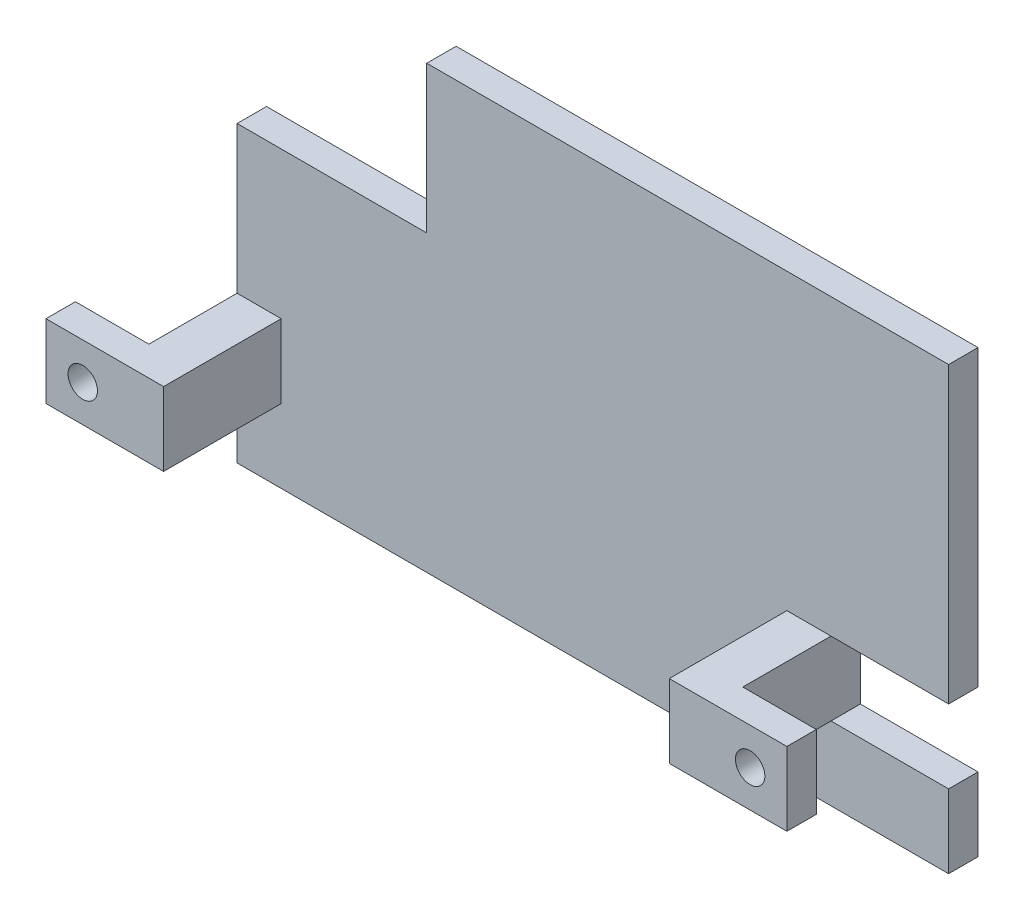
SolidWorks part; units mm, degrees
ref_plane "Alzado" through (0, 0, 0) normal (0, 0, 1) x (1, 0, 0)
ref_plane "Planta" through (0, 0, 0) normal (0, 1, 0) x (1, 0, 0)
ref_plane "Vista lateral" through (0, 0, 0) normal (1, 0, 0) x (0, 0, -1)
sketch "Croquis1" plane through (0, 0, 0) normal (0, 0, 1) x (1, 0, 0)
  line L1 (-0.3876, 13.329) -> (48.0124, 13.329)
  line L2 (-0.3876, 13.329) -> (-0.3876, -16.671)
  line L3 (-0.3876, -16.671) -> (48.0124, -16.671)
  line L4 (48.0124, 13.329) -> (48.0124, -16.671)
  dimension "D1" = 30
  dimension "D2" = 48.4
extrude "Saliente-Extruir1" add sketch "Croquis1" along normal blind 2
sketch "Croquis2" plane through (0, 0, 2) normal (0, 0, 1) x (1, 0, 0)
  line L0 (-0.3876, -6.671) -> (48.0124, -6.671) construction
  line L1 (-0.3876, 13.329) -> (-0.3876, -16.671) construction
  line L2 (48.0124, -16.671) -> (48.0124, 13.329) construction
  line L3 (48.0124, 13.329) -> (-0.3876, 13.329) construction
  line L4 (-0.3876, -11.671) -> (48.0124, -11.671) construction
  line L5 (40.0124, -11.671) -> (40.0124, -6.671)
  line L6 (-0.3876, -16.671) -> (48.0124, -16.671) construction
  line L7 (40.0124, -11.671) -> (40.0124, -6.671) construction
  line L8 (40.0124, -6.671) -> (48.0124, -6.671)
  line L9 (48.0124, -6.671) -> (48.0124, -11.671)
  line L10 (48.0124, -11.671) -> (40.0124, -11.671)
  dimension "D1" = 20
  dimension "D2" = 5
  dimension "D3" = 5
  dimension "D4" = 8
extrude "Cortar-Extruir1" cut sketch "Croquis2" against normal blind 2
sketch "Croquis3" plane through (0, 0, 2) normal (0, 0, 1) x (1, 0, 0)
  line L0 (40.0124, -6.671) -> (40.0124, -11.671)
  line L1 (40.0124, -6.671) -> (37.0124, -6.671)
  line L2 (40.0124, -11.671) -> (37.0124, -11.671)
  line L3 (37.0124, -6.671) -> (37.0124, -11.671)
  line L4 (37.0124, -11.671) -> (-0.3876, -11.671) construction
  line L5 (-0.3876, 13.329) -> (-0.3876, -16.671) construction
  line L7 (-0.3876, -11.671) -> (2.6124, -11.671)
  line L8 (-0.3876, -11.671) -> (-0.3876, -6.671)
  line L9 (-0.3876, -6.671) -> (2.6124, -6.671)
  line L10 (2.6124, -11.671) -> (2.6124, -6.671)
  dimension "D1" = 3
  dimension "D2" = 5
  dimension "D3" = 3
extrude "Saliente-Extruir2" add sketch "Croquis3" along normal blind 8
sketch "Croquis4" plane through (0, 0, 10) normal (0, 0, 1) x (1, 0, 0)
  line L0 (-0.3876, -11.671) -> (-0.3876, -6.671)
  line L1 (-0.3876, -11.671) -> (-5.3876, -11.671)
  line L2 (-0.3876, -6.671) -> (-5.3876, -6.671)
  line L3 (-5.3876, -11.671) -> (-5.3876, -6.671)
  line L4 (40.0124, -6.671) -> (40.0124, -11.671)
  line L5 (40.0124, -6.671) -> (45.0124, -6.671)
  line L6 (40.0124, -11.671) -> (45.0124, -11.671)
  line L7 (45.0124, -6.671) -> (45.0124, -11.671)
  line L8 (-5.3876, -11.671) -> (-0.3876, -6.671) construction
  line L9 (-5.3876, -6.671) -> (-0.3876, -11.671) construction
  line L10 (40.0124, -11.671) -> (45.0124, -6.671) construction
  line L11 (45.0124, -11.671) -> (40.0124, -6.671) construction
  circle A0 centre (-2.8876, -9.171) radius 1
  circle A1 centre (42.5124, -9.171) radius 1
  point P0 (-2.8876, -9.171)
  point P15 (42.5124, -9.171)
  dimension "D3" = 2
  dimension "D4" = 2
  dimension "D1" = 5
  dimension "D2" = 5
extrude "Saliente-Extruir3" add sketch "Croquis4" against normal blind 2
sketch "Croquis5" plane through (0, 0, 0) normal (0, 0, -1) x (-1, 0, 0)
  line L0 (-48.0124, -16.671) -> (-48.0124, -11.671)
  line L1 (-48.0124, -16.671) -> (-40.0124, -16.671)
  line L2 (-48.0124, -11.671) -> (-40.0124, -11.671)
  line L3 (-40.0124, -16.671) -> (-40.0124, -11.671)
  line L4 (-12.5124, -16.671) -> (-12.5124, 13.329) construction
  line L5 (0.3876, -16.671) -> (-48.0124, -16.671) construction
  line L6 (-48.0124, 13.329) -> (0.3876, 13.329) construction
  line L7 (-12.5124, -16.671) -> (-12.5124, -11.671)
  line L8 (-12.5124, -16.671) -> (-20.5124, -16.671)
  line L9 (-12.5124, -11.671) -> (-20.5124, -11.671)
  line L10 (-20.5124, -16.671) -> (-20.5124, -11.671)
  line L11 (-12.5124, 13.329) -> (-12.5124, 8.329)
  line L12 (-12.5124, 13.329) -> (-20.5124, 13.329)
  line L13 (-12.5124, 8.329) -> (-20.5124, 8.329)
  line L14 (-20.5124, 13.329) -> (-20.5124, 8.329)
  line L15 (-48.0124, 13.329) -> (-48.0124, 8.329)
  line L16 (-48.0124, 13.329) -> (-40.0124, 13.329)
  line L17 (-48.0124, 8.329) -> (-40.0124, 8.329)
  line L18 (-40.0124, 13.329) -> (-40.0124, 8.329)
  line L20 (-48.0124, -6.671) -> (-48.0124, 13.329) construction
  line L21 (-45.5124, -11.671) -> (-45.5124, -16.671) construction
  line L22 (-45.5124, -15.171) -> (-40.0124, -15.171) construction
  line L23 (-45.5124, -13.171) -> (-40.0124, -13.171) construction
  line L24 (-12.5124, -15.171) -> (-20.5124, -15.171) construction
  line L25 (-45.5124, 8.329) -> (-45.5124, 13.329) construction
  line L26 (-45.5124, 11.829) -> (-12.5124, 11.829) construction
  line L27 (-40.0124, 9.829) -> (-45.5124, 9.829) construction
  line L28 (-20.5124, -13.171) -> (-12.5124, -13.171) construction
  line L29 (-20.5124, 9.829) -> (-12.5124, 9.829) construction
  line L30 (-13.5124, 13.329) -> (-13.5124, -16.2598) construction
  circle A0 centre (-44.5124, -14.171) radius 1
  circle A1 centre (-44.5124, 10.829) radius 1
  circle A2 centre (-14.5124, 10.829) radius 1
  circle A3 centre (-14.5124, -14.171) radius 1
  dimension "D1" = 8
  dimension "D2" = 35.5
  dimension "D3" = 5
  dimension "D4" = 8
  dimension "D5" = 8
  dimension "D6" = 5
  dimension "D7" = 8
  dimension "D8" = 5
  dimension "D9" = 2.5
  dimension "D10" = 1.5
  dimension "D11" = 2
  dimension "D12" = 1.5
  dimension "D13" = 2
  dimension "D14" = 1
sketch "Croquis7" plane through (0, 0, 0) normal (0, 0, -1) x (-1, 0, 0)
  line L0 (-12.5124, -16.671) -> (-12.5124, 13.329) construction
  line L1 (0.3876, 13.329) -> (-12.5124, 13.329)
  line L2 (0.3876, 13.329) -> (0.3876, 3.329)
  line L3 (0.3876, 3.329) -> (-12.5124, 3.329)
  line L4 (-12.5124, 13.329) -> (-12.5124, 3.329)
  dimension "D1" = 10
  dimension "D2" = 12.9
extrude "Cortar-Extruir2" cut sketch "Croquis7" against normal blind 10
